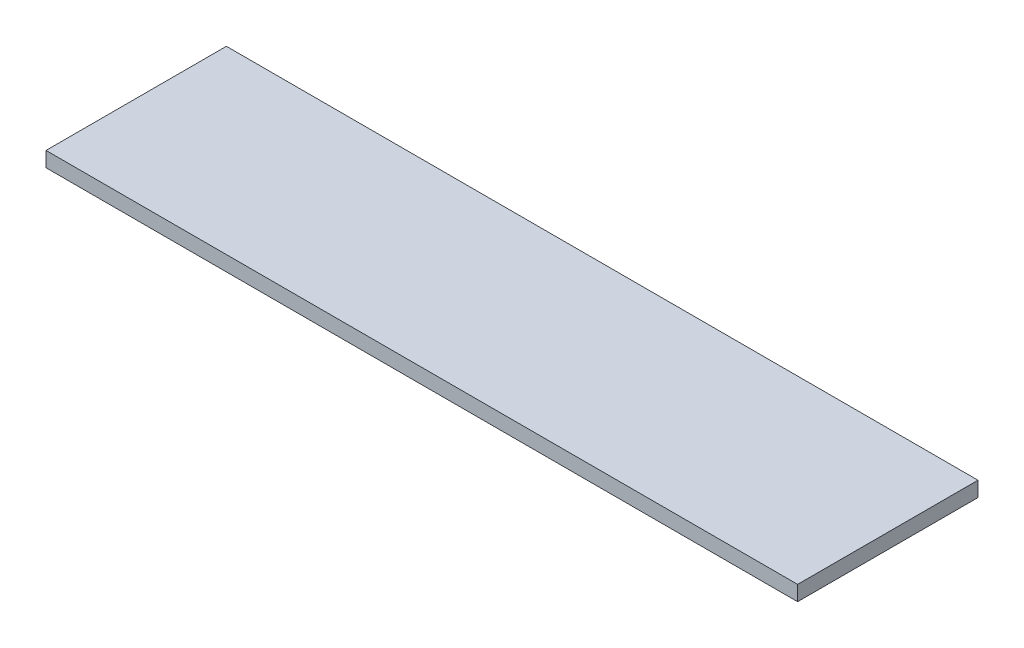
SolidWorks part; units mm, degrees
ref_plane "Front Plane" through (0, 0, 0) normal (0, 0, 1) x (1, 0, 0)
ref_plane "Top Plane" through (0, 0, 0) normal (0, 1, 0) x (1, 0, 0)
ref_plane "Right Plane" through (0, 0, 0) normal (1, 0, 0) x (0, 0, -1)
sketch "Sketch1" plane through (0, 0, 0) normal (0, 0, 1) x (1, 0, 0)
  line L0 (2438.4, 50.8) -> (2489.2, 50.8)
  line L1 (0, 0) -> (2438.4, 0)
  line L2 (0, 0) -> (0, 50.8)
  line L4 (2438.4, 0) -> (2438.4, 50.8)
  line L5 (2489.2, 50.8) -> (2489.2, 101.6)
  line L6 (2489.2, 101.6) -> (-50.8, 101.6)
  line L7 (-50.8, 101.6) -> (-50.8, 50.8)
  line L8 (-50.8, 50.8) -> (0, 50.8)
  dimension "D1" = 50.8
  dimension "D2" = 2540
  dimension "D3" = 50.8
  dimension "D4" = 2438.4
  dimension "D5" = 50.8
extrude "Boss-Extrude1" add sketch "Sketch1" along normal blind 609.6
sketch "Sketch2" plane through (2438.4, 0, 0) normal (1, 0, 0) x (0, 0, -1)
  line L0 (-609.6, 0) -> (0, 0) construction
  line L1 (-609.6, 50.8) -> (-533.4, 50.8)
  line L2 (-609.6, 50.8) -> (-609.6, 0)
  line L3 (-609.6, 0) -> (-533.4, 0)
  line L4 (-533.4, 50.8) -> (-533.4, 0)
  dimension "D1" = 76.2
extrude "Cut-Extrude1" cut sketch "Sketch2" against normal up to next
